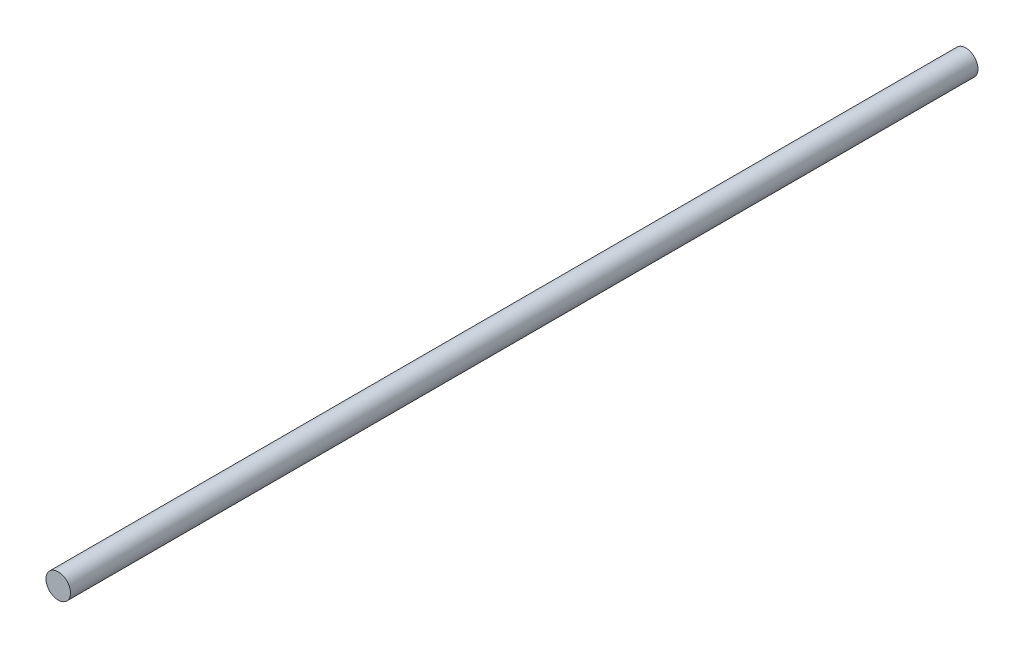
SolidWorks part; units mm, degrees
ref_plane "Plan de face" through (0, 0, 0) normal (0, 0, 1) x (1, 0, 0)
ref_plane "Plan de dessus" through (0, 0, 0) normal (0, 1, 0) x (1, 0, 0)
ref_plane "Plan de droite" through (0, 0, 0) normal (1, 0, 0) x (0, 0, -1)
sketch "Esquisse1" plane through (0, 0, 0) normal (0, 0, 1) x (1, 0, 0)
  circle A0 centre (0, 0) radius 5
  point P3 (-5, 0)
  dimension "D1" = 10
extrude "Boss.-Extru.1" add sketch "Esquisse1" along normal blind 370
sketch3d "Esquisse3D1"
  line L0 (0, 0, 0) -> (6.3074, 0, 0) construction
  line L1 (0, 0, 0) -> (6.3074, 0, 0) construction
  line L2 (0, 0, 370) -> (20.4607, 0, 370) construction
  line L3 (0, 0, 370) -> (0, 0, 0) construction
  circle A0 centre (0, 0, 370) radius 5 construction
  circle A1 centre (0, 0, 0) radius 5 construction
  point P1 (5, 0, 0)
  point P6 (0, 0, 5)
  point P11 (5, 0, 370)
  point P15 (0, 0, 375)
ref_plane "Plan1" through (5, 0, 370) normal (1, 0, 0) x (0, 0, -1)
ref_plane "Plan2" through (5, 0, 0) normal (1, 0, 0) x (0, 0, -1)
